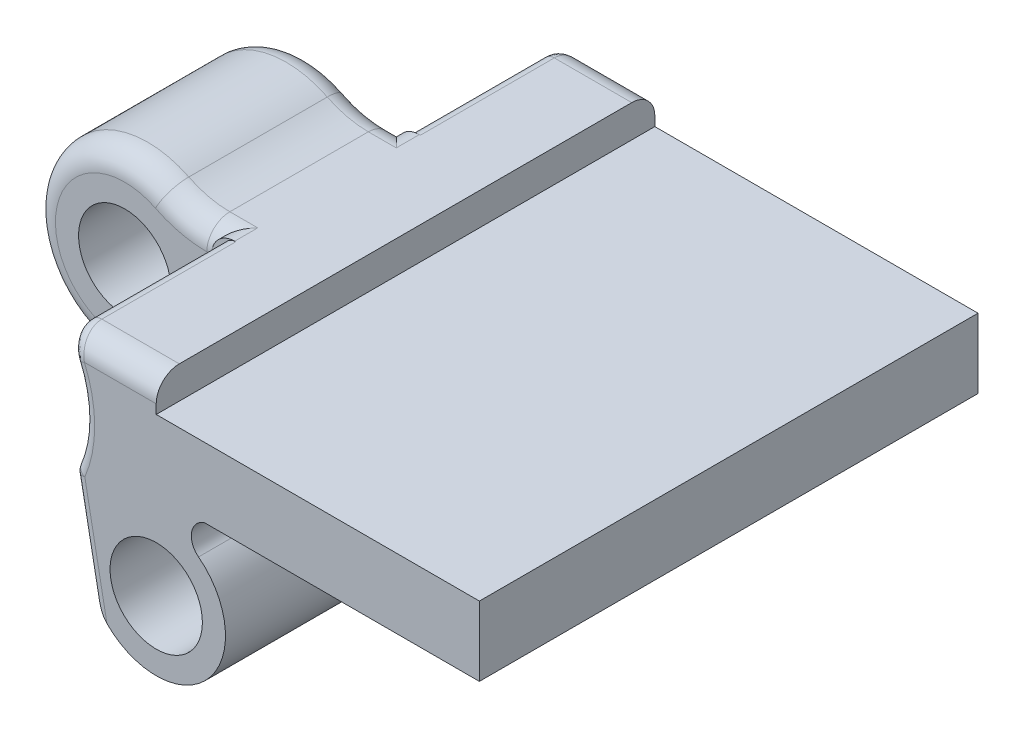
SolidWorks part; units mm, degrees
ref_plane "Front Plane" through (0, 0, 0) normal (0, 0, 1) x (1, 0, 0)
ref_plane "Top Plane" through (0, 0, 0) normal (0, 1, 0) x (1, 0, 0)
ref_plane "Right Plane" through (0, 0, 0) normal (1, 0, 0) x (0, 0, -1)
sketch "Sketch1" plane through (0, 0, 0) normal (0, 0, 1) x (1, 0, 0)
  line L0 (-62.8579, 9.0997) -> (-8.2586, -17.1668)
  line L2 (13.3301, 24.0627) -> (101.6, 24.0627)
  line L3 (101.6, 24.0627) -> (101.6, 52.0974)
  line L4 (101.6, 52.0974) -> (-29.2722, 52.0974)
  circle A0 centre (-51.8465, 31.9888) radius 12.7
  circle A1 centre (0, 0) radius 12.7
  arc A2 (-40.5593, 54.7431) -> (-62.8579, 9.0997) centre (-51.8465, 31.9888) ccw
  arc A3 (-8.2586, -17.1668) -> (11.6383, 15.0815) centre (0, 0) ccw
  arc A4 (11.6383, 15.0815) -> (13.3301, 24.0627) centre (14.7713, 19.1413) cw
  arc A5 (-29.2722, 52.0974) -> (-40.5593, 54.7431) centre (-29.2722, 77.4974) cw
  dimension "D1" = 25.4
extrude "Extrude1" add sketch "Sketch1" along normal mid plane 137.16
sketch "Sketch3" plane through (0, 0, 68.58) normal (0, 0, 1) x (1, 0, 0)
  line L0 (-29.2722, 52.0974) -> (-18.396, -4.9486)
  line L2 (-8.2586, -17.1668) -> (-62.8579, 9.0997)
  arc A0 (-40.5593, 54.7431) -> (-62.8579, 9.0997) centre (-51.8465, 31.9888) ccw
  arc A1 (-18.396, -4.9486) -> (-8.2586, -17.1668) centre (0, 0) ccw
  arc A2 (-40.5593, 54.7431) -> (-29.2722, 52.0974) centre (-29.2722, 77.4974) ccw
  arc A3 (-40.5593, 54.7431) -> (-29.2722, 52.0974) centre (-29.2722, 77.4974) ccw construction
extrude "Cut-Extrude1" cut sketch "Sketch3" against normal blind 43.18
mirror "Mirror1" about plane through (0, 0, 0) normal (0, 0, 1) of "Cut-Extrude1"
fillet "Fillet1" radius 6.35 10 edges at (-35.0687, 52.7677, -25.4) (-74.6686, 43.1382, -25.4) (-35.0687, 52.7677, 25.4) (-35.5582, -4.0335, 25.4) (-35.5582, -4.0335, -25.4) (-74.6686, 43.1382, 25.4) (-29.2722, 52.0974, -46.99) (-29.2722, 52.0974, 46.99) (36.1639, 52.0974, 68.58) (36.1639, 52.0974, -68.58)
fillet "Fillet3" radius 3.175 6 edges at (-26.0872, 50.2376, -66.7201) (-27.919, 45.1502, -68.58) (-23.1154, 19.8048, -68.58) (-26.0872, 50.2376, 66.7201) (-27.919, 45.1502, 68.58) (-23.1154, 19.8048, 68.58)
sketch "Sketch4" plane through (0, 0, 25.4) normal (0, 0, 1) x (1, 0, 0)
  circle A0 centre (-51.8465, 31.9888) radius 31.75
extrude "Cut-Extrude2" cut sketch "Sketch4" along normal blind 44.45
mirror "Mirror2" about plane through (0, 0, 0) normal (0, 0, 1) of "Cut-Extrude2"
fillet "Fillet4" radius 3.175 10 edges at (-22.9361, 18.8643, -45.4025) (-22.3981, 20.1206, -67.4706) (-25.9553, 50.3657, -44.9046) (-25.9553, 50.3657, 44.9046) (-22.9361, 18.8643, 45.4025) (-22.3981, 20.1206, 67.4706) (-20.2997, 35.5749, -68.58) (-20.2997, 35.5749, 68.58)
sketch "Sketch5" plane through (0, 0, 0) normal (0, 0, 1) x (1, 0, 0)
  line L0 (14.2654, -12.6254) -> (71.1782, 24.0627)
  line L1 (13.3301, 24.0627) -> (101.6, 24.0627) construction
  arc A0 (-13.5554, -13.3848) -> (11.6383, 15.0815) centre (0, 0) ccw construction
rib "Rib4" sketch "Sketch5" sketch "Sketch5" thickness 12.54 extrusion direction parallel to sketch draft on no parameters "D1"=12.54
sketch "Sketch6" plane through (101.6, 0, 0) normal (1, 0, 0) x (0, 0, -1)
  line L1 (-68.58, 24.0627) -> (71.0099, 24.0627)
  line L2 (-68.58, 24.0627) -> (-68.58, 57.2385)
  line L3 (-68.58, 57.2385) -> (71.0099, 57.2385)
  line L4 (71.0099, 24.0627) -> (71.0099, 57.2385)
extrude "Cut-Extrude3" cut sketch "Sketch6" against normal blind 12.7
sketch "Sketch7" plane through (0, 52.0974, 0) normal (0, 1, 0) x (1, 0, 0)
  line L0 (-19.7458, 68.58) -> (88.9, 68.58) construction
  line L1 (88.9, -68.58) -> (0, -68.58)
  line L2 (88.9, -68.58) -> (88.9, 68.58)
  line L3 (88.9, 68.58) -> (0, 68.58)
  line L4 (0, -68.58) -> (0, 68.58)
extrude "Cut-Extrude4" cut sketch "Sketch7" against normal blind 8.89
